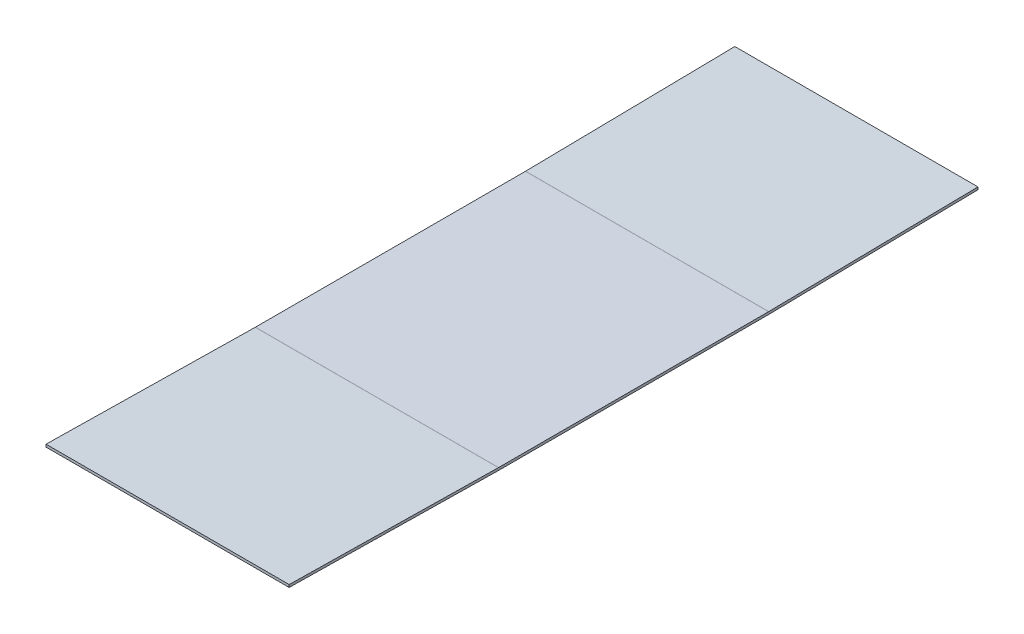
SolidWorks part; units mm, degrees
ref_plane "Front Plane" through (0, 0, 0) normal (0, 0, 1) x (1, 0, 0)
ref_plane "Top Plane" through (0, 0, 0) normal (0, 1, 0) x (1, 0, 0)
ref_plane "Right Plane" through (0, 0, 0) normal (1, 0, 0) x (0, 0, -1)
sketch "Sketch1" plane through (0, 0, 0) normal (1, 0, 0) x (0, 0, -1)
  line L0 (-254, 4.7502) -> (-647.5722, 11.1002)
  line L1 (-254, 0.0004) -> (254, 0.0004)
  line L2 (254, 4.7502) -> (647.5722, 11.1002)
  line L3 (-254, 4.7502) -> (254, 4.7502)
  line L5 (-254, 0.0004) -> (-647.6488, 6.3516)
  line L6 (-647.5722, 11.1002) -> (-647.6488, 6.3516)
  line L7 (254, 0.0004) -> (647.6488, 6.3516)
  line L8 (647.6488, 6.3516) -> (647.5722, 11.1002)
  dimension "D1" = 508
  dimension "D2" = 6.35
  dimension "D3" = 4.7498
  dimension "D4" = 6.35
  dimension "D5" = 393.7
  dimension "D6" = 393.7
  dimension "D7" = 254
  dimension "D8" = 508
extrude "Extrude1" add sketch "Sketch1" against normal blind 457.2
fillet "Fillet1" radius 25.4 2 edges at (-228.6, 4.7502, -254) (-228.6, 4.7502, 254)
fillet "Fillet2" radius 25.4 1 edges at (-228.6, 0.0004, 254)
fillet "Fillet3" radius 25.4 1 edges at (-228.6, 0.0004, -254)
